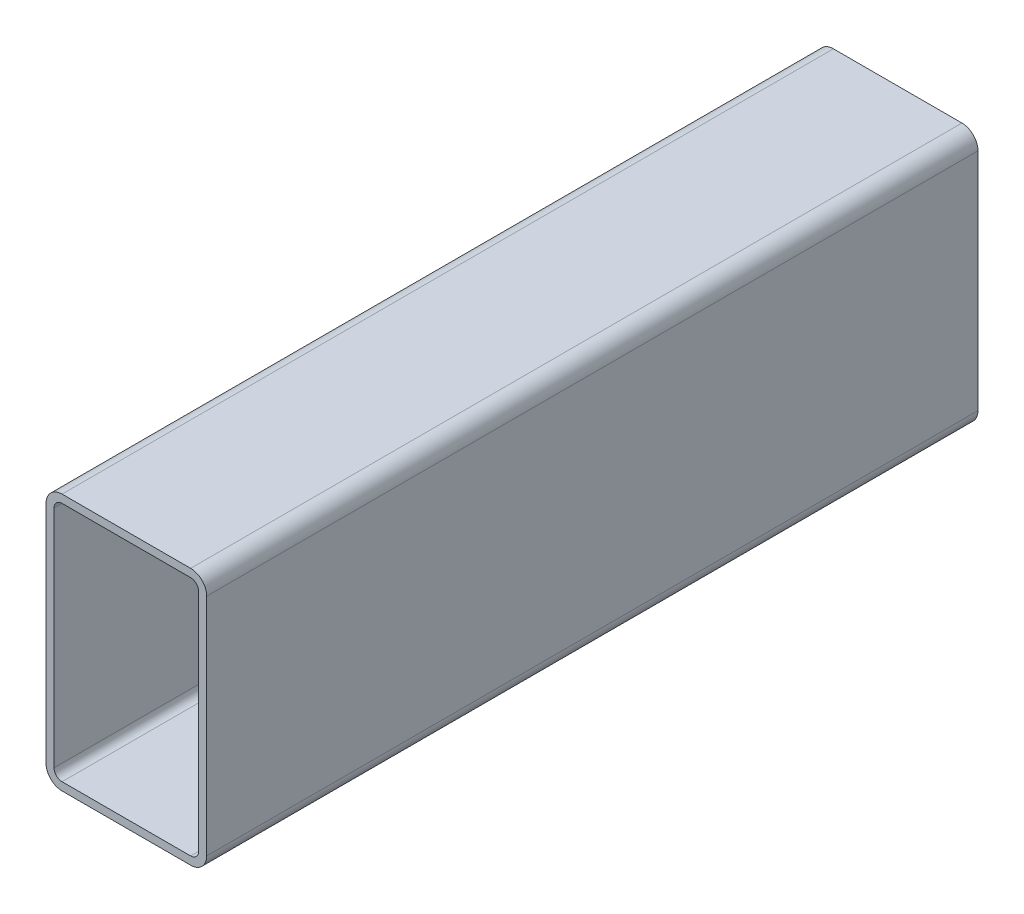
SolidWorks part; units mm, degrees
ref_plane "Front Plane" through (0, 0, 0) normal (0, 0, 1) x (1, 0, 0)
ref_plane "Top Plane" through (0, 0, 0) normal (0, 1, 0) x (1, 0, 0)
ref_plane "Right Plane" through (0, 0, 0) normal (1, 0, 0) x (0, 0, -1)
sketch "Sketch1" plane through (0, 0, 0) normal (0, 0, 1) x (1, 0, 0)
sketch_block_instance "HSS4x2.5x0.125-1"
sketch_block "HSS4x2.5x0.125"
extrude "Boss-Extrude1" add sketch "Sketch1" along normal blind 304.8
